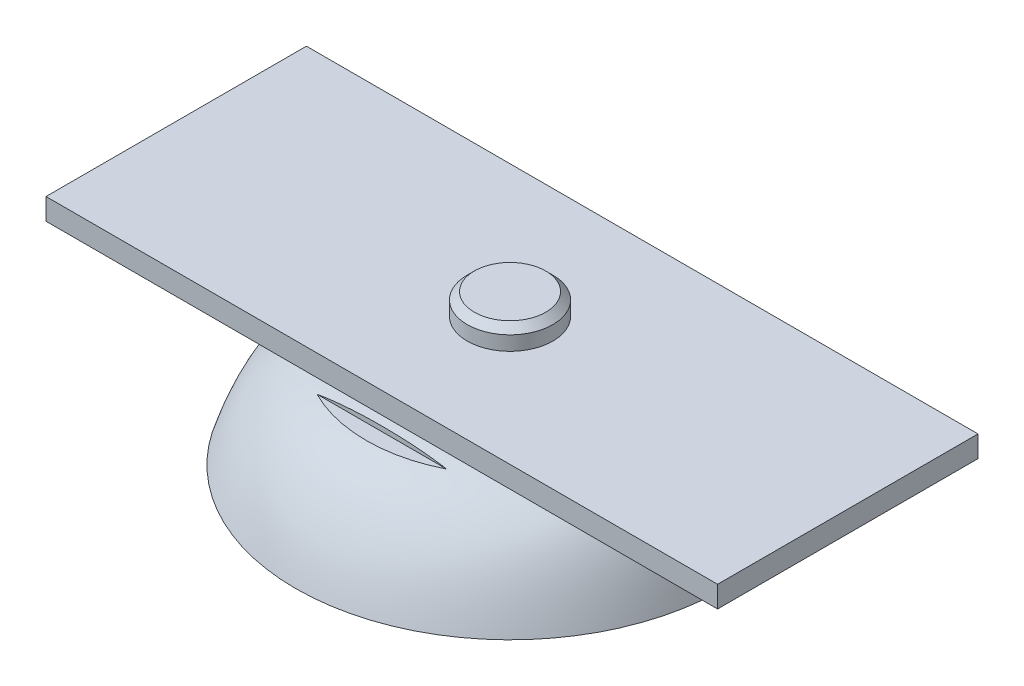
SolidWorks part; units mm, degrees
ref_plane "Front Plane" through (0, 0, 0) normal (0, 0, 1) x (1, 0, 0)
ref_plane "Top Plane" through (0, 0, 0) normal (0, 1, 0) x (1, 0, 0)
ref_plane "Right Plane" through (0, 0, 0) normal (1, 0, 0) x (0, 0, -1)
sketch "Sketch1" plane through (0, 0, 0) normal (0, 1, 0) x (1, 0, 0)
  line L1 (42, -32.5) -> (-42, -32.5)
  line L2 (47, -27.5) -> (47, 27.5)
  line L3 (42, 32.5) -> (-42, 32.5)
  line L4 (-47, -27.5) -> (-47, 27.5)
  line L5 (47, -32.5) -> (-47, 32.5) construction
  line L6 (47, 32.5) -> (-47, -32.5) construction
  arc A0 (42, -32.5) -> (47, -27.5) centre (42, -27.5) ccw
  arc A1 (47, 27.5) -> (42, 32.5) centre (42, 27.5) ccw
  arc A2 (-42, 32.5) -> (-47, 27.5) centre (-42, 27.5) ccw
  arc A3 (-42, -32.5) -> (-47, -27.5) centre (-42, -27.5) cw
  point P0 (0, 0)
  dimension "D3" = 5
  dimension "D1" = 65
  dimension "D2" = 94
extrude "Boss-Extrude1" add sketch "Sketch1" along normal blind 3
sketch "Sketch2" plane through (0, 3, 0) normal (0, 1, 0) x (1, 0, 0)
  line L0 (39, 0) -> (-39, 0) construction
  line L1 (-39, -22.5) -> (-39, 22.5) construction
  line L2 (39, 17.6891) -> (39, -17.6891) construction
  line L3 (-39, 22.5) -> (-35, 22.5) construction
  line L4 (-39, 26.5) -> (-35, 26.5)
  line L5 (-39, 18.5) -> (-35, 18.5)
  line L6 (0, 0) -> (0, 12.606) construction
  line L7 (39, 22.5) -> (35, 22.5) construction
  line L8 (39, 26.5) -> (35, 26.5)
  line L9 (39, 18.5) -> (35, 18.5)
  line L10 (-39, -22.5) -> (-35, -22.5) construction
  line L11 (-39, -26.5) -> (-35, -26.5)
  line L12 (-39, -18.5) -> (-35, -18.5)
  line L13 (39, -22.5) -> (35, -22.5) construction
  line L14 (39, -26.5) -> (35, -26.5)
  line L15 (39, -18.5) -> (35, -18.5)
  arc A0 (-39, 26.5) -> (-39, 18.5) centre (-39, 22.5) ccw
  arc A1 (-35, 18.5) -> (-35, 26.5) centre (-35, 22.5) ccw
  arc A2 (39, 26.5) -> (39, 18.5) centre (39, 22.5) cw
  arc A3 (35, 18.5) -> (35, 26.5) centre (35, 22.5) cw
  arc A4 (-39, -26.5) -> (-39, -18.5) centre (-39, -22.5) cw
  arc A5 (-35, -18.5) -> (-35, -26.5) centre (-35, -22.5) cw
  arc A6 (39, -26.5) -> (39, -18.5) centre (39, -22.5) ccw
  arc A7 (35, -18.5) -> (35, -26.5) centre (35, -22.5) ccw
  point P0 (-37, 22.5)
  point P4 (0, 0)
  point P8 (-39, 0)
  point P11 (39, 0)
  point P19 (-31, 22.5)
  point P20 (31, 22.5)
  point P23 (37, 22.5)
  point P29 (-37, -22.5)
  point P36 (37, -22.5)
  point P41 (31, -22.5)
  point P42 (-31, -22.5)
  dimension "D1" = 8
  dimension "D2" = 4
  dimension "D3" = 45
  dimension "D4" = 74
extrude "Cut-Extrude1" cut sketch "Sketch2" against normal through all
sketch "Sketch3" plane through (0, 0, 0) normal (0, 0, 1) x (1, 0, 0)
  line L0 (0, 0) -> (0, -15.8542) construction
  line L2 (-42, 0) -> (42, 0) construction
  line L3 (-30, -15) -> (-29.0476, -15.3049)
  line L4 (0, 0) -> (0, -1)
  spline S0 degree 3 poles (0, 0) (-20.874, 0) (-25.7094, -1.5969) (-30, -15) knots 0 0 0 0 1 1 1 1
  spline S1 degree 1 poles (0, -1) (-29.0476, -15.3049) knots 0 0 1 1 construction
  spline S2 degree 3 poles (0, -1) (-0.635, -1) (-1.9275, -1.0031) (-4.3319, -1.0242) (-7.1316, -1.0832) (-10.143, -1.2204) (-13.735, -1.5105) (-17.4745, -2.1075) (-20.925, -3.2874) (-23.5575, -5.0027) (-25.3128, -7.0103) (-26.5577, -9.0728) (-27.4272, -10.8652) (-28.1153, -12.5831) (-28.6488, -14.085) (-28.9188, -14.9025) (-29.0476, -15.3049) knots 0 0 0 0 0.03125 0.0625 0.125 0.1875 0.25 0.375 0.5 0.625 0.75 0.8125 0.875 0.9375 0.96875 1 1 1 1
  dimension "D1" = 30
  dimension "D2" = 15
  dimension "D3" = 1
revolve "Revolve1" add sketch "Sketch3" angle 360 about L0
sketch "Sketch4" plane through (0, 3, 0) normal (0, 1, 0) x (1, 0, 0)
  circle A0 centre (0, 0) radius 6
  dimension "D1" = 12
extrude "Boss-Extrude2" add sketch "Sketch4" along normal blind 3
chamfer "Chamfer1" distance 1 angle 45 1 edges at (0, 6, 6)
sketch "Sketch5" plane through (0, 3, 0) normal (0, 1, 0) x (1, 0, 0)
  line L0 (-47, 27.5) -> (-47, -27.5) construction
  line L1 (-47, 18.5) -> (47, 18.5)
  line L2 (-47, 18.5) -> (-47, -17.9494)
  line L3 (-47, -17.9494) -> (47, -17.9494)
  line L4 (47, 18.5) -> (47, -17.9494)
  line L5 (47, -27.5) -> (47, 27.5) construction
  line L7 (-52.2874, 36.4191) -> (-49.5994, 36.4191)
  line L8 (-52.2874, 36.4191) -> (-52.2874, 32.7772)
  line L9 (-52.2874, 32.7772) -> (-49.5994, 32.7772)
  line L10 (-49.5994, 36.4191) -> (-49.5994, 32.7772)
  line L11 (57.4902, -39.454) -> (-53.8483, -39.454)
  line L12 (57.4902, -39.454) -> (57.4902, 38.9338)
  line L13 (57.4902, 38.9338) -> (-53.8483, 38.9338)
  line L14 (-53.8483, -39.454) -> (-53.8483, 38.9338)
extrude "Cut-Extrude2" cut sketch "Sketch5" against normal blind 5 contours L12 L11 L14 L13 | L2 L1 L4 L3
